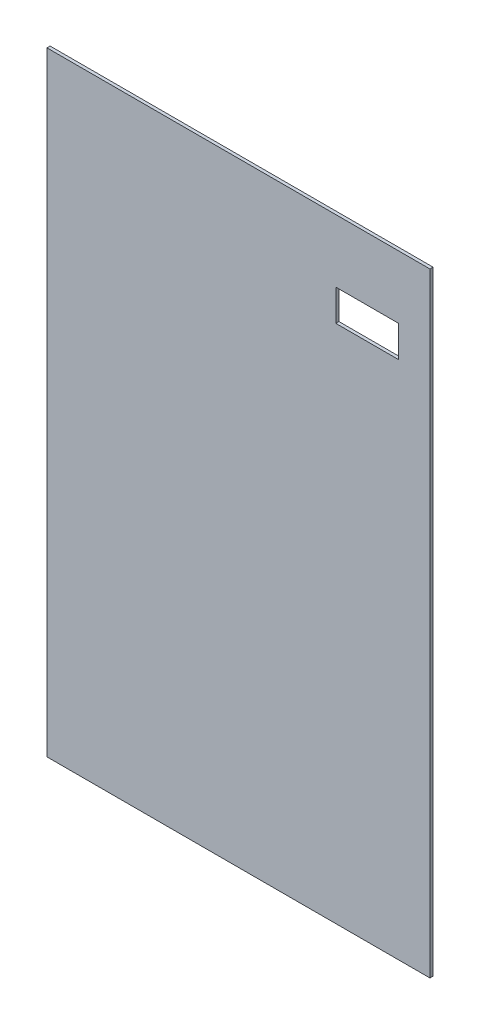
SolidWorks part; units mm, degrees
ref_plane "Front Plane" through (0, 0, 0) normal (0, 0, 1) x (1, 0, 0)
ref_plane "Top Plane" through (0, 0, 0) normal (0, 1, 0) x (1, 0, 0)
ref_plane "Right Plane" through (0, 0, 0) normal (1, 0, 0) x (0, 0, -1)
sketch "Sketch1" plane through (0, 0, 0) normal (0, 0, 1) x (1, 0, 0)
  line L2 (0, 0) -> (1220, 0)
  line L3 (0, 0) -> (0, 1955.8)
  line L4 (0, 1955.8) -> (1220, 1955.8)
  line L5 (1220, 0) -> (1220, 1955.8)
  dimension "D1" = 1220
  dimension "D2" = 1955.8
extrude "Boss-Extrude1" add sketch "Sketch1" along normal blind 10
sketch "Sketch2" plane through (0, 0, 10) normal (0, 0, 1) x (1, 0, 0)
  line L6 (920, 1755.8) -> (1120, 1755.8)
  line L7 (920, 1755.8) -> (920, 1655.8)
  line L8 (920, 1655.8) -> (1120, 1655.8)
  line L9 (1120, 1755.8) -> (1120, 1655.8)
  line L10 (1220, 1955.8) -> (0, 1955.8) construction
  line L11 (1220, 0) -> (1220, 1955.8) construction
  dimension "D3" = 100
  dimension "D4" = 200
  dimension "D7" = 200
  dimension "D8" = 100
extrude "Cut-Extrude1" cut sketch "Sketch2" against normal through all
